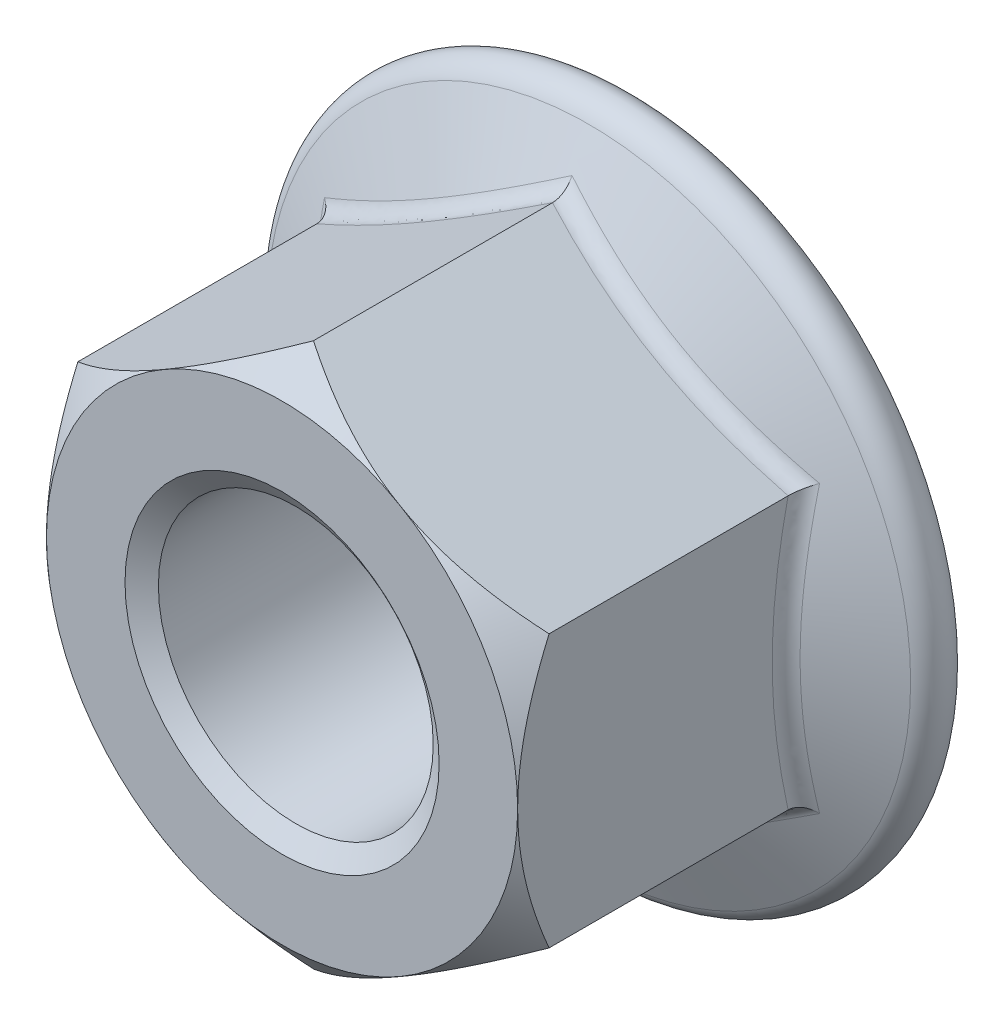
SolidWorks part; units mm, degrees
extrude "BaseNut" add sketch "BaseNutSke" against normal blind 22.5298
sketch "BaseNutSke" plane through (0, 0, 0) normal (0, 0, 1) x (1, 0, 0)
  line L6 (15, 8.6603) -> (15, -8.6603)
  line L7 (-15, 8.6603) -> (-15, -8.6603)
  line L8 (15, 8.6603) -> (0, 17.3205)
  line L9 (0, 17.3205) -> (-15, 8.6603)
  line L10 (-15, -8.6603) -> (0, -17.3205)
  line L11 (0, -17.3205) -> (15, -8.6603)
  circle A0 centre (0, 0) radius 8.75
pattern_linear "ThdSchPat" [suppressed]
revolve "ThreadSchematic" cut sketch "ThdSchSke" angle 360 about L6
sketch "ThdSchSke" plane through (0, 0, 0) normal (0, 1, 0) x (1, 0, 0)
  line L0 (-10, 0.0254) -> (-8.75, 0.9007)
  line L1 (-8.75, 0.9007) -> (-4.375, 0.9007)
  line L2 (-4.375, 0.9007) -> (-4.375, -0.8499)
  line L3 (-4.375, -0.8499) -> (-8.75, -0.8499)
  line L4 (-8.75, -0.8499) -> (-10, 0.0254)
  line L5 (-3.175, 3.175) -> (3.175, 3.175) construction
  line L6 (0, 3.175) -> (0, -2.9874) construction
  line L7 (0, 21.6291) -> (0, 0.8753) construction
ref_plane "Plane1" through (0, 0, 0) normal (0, 0, 1) x (1, 0, 0)
ref_plane "Plane2" through (0, 0, 0) normal (0, 1, 0) x (1, 0, 0)
ref_plane "Plane3" through (0, 0, 0) normal (1, 0, 0) x (0, 0, -1)
other "Configuration Table"
sketch "Sketch6" plane through (0, 0, 0) normal (1, 0, 0) x (0, 0, -1)
  line L0 (14.0547, 8.75) -> (19.5298, 20.4914)
  line L1 (22.5298, 8.75) -> (22.5298, 19.8263)
  line L2 (19.5298, 32.3999) -> (19.5298, 20.4914) construction
  line L3 (23.6804, 21.4) -> (19.4832, 21.4) construction
  line L4 (22.5298, 8.75) -> (14.0547, 8.75)
  line L5 (23.6804, -21.4) -> (19.4832, -21.4) construction
  line L6 (22.5298, 8.6603) -> (22.5298, 17.3205) construction
  line L7 (0, 0) -> (32.9582, 0) construction
  line L8 (22.5298, -8.75) -> (14.0547, -8.75) construction
  line L9 (22.5298, 0) -> (0, 0) construction
  arc A0 (22.5298, 19.8263) -> (19.5298, 20.4914) centre (20.9561, 19.8263) ccw
revolve "Flange" add sketch "Sketch6" angle 360 about L7
sketch "Sketch3" plane through (0, 0, 0) normal (1, 0, 0) x (0, 0, -1)
  line L0 (22.5298, 15) -> (20.5298, 17.3205) construction
  line L1 (20.5298, 17.3205) -> (20.5298, 30.0205) construction
  line L2 (20.5298, 30.0205) -> (35.2298, 30.0205) construction
  line L3 (35.2298, 30.0205) -> (35.2298, 15) construction
  line L4 (35.2298, 15) -> (22.5298, 15) construction
  line L5 (22.5298, 8.6603) -> (22.5298, 17.3205) construction
  line L6 (18.0512, 17.3205) -> (0, 17.3205) construction
  line L7 (0, 0) -> (38.6776, 0) construction
  line L8 (22.5298, 0) -> (0, 0) construction
  line L9 (11.2649, 17.3205) -> (11.2649, 44.222) construction
  line L10 (2, 30.0205) -> (-12.7, 30.0205)
  line L11 (-12.7, 30.0205) -> (-12.7, 15)
  line L12 (-12.7, 15) -> (0, 15)
  line L13 (0, 15) -> (2, 17.3205)
  line L14 (2, 17.3205) -> (2, 30.0205)
  line L16 (18.0512, 17.3205) -> (0, 17.3205) construction
revolve "Double-Chamfer" cut sketch "Sketch3" angle 360 about L7
fillet "FlangeFillet" radius 1.2 6 edges at (4.0104, 15.0051, -17.2171) (-10.9896, 10.9757, -17.2171) (-4.0104, -15.0051, -17.2171) (10.9896, -10.9757, -17.2171)
sketch "Sketch5" plane through (0, 0, 0) normal (1, 0, 0) x (0, 0, -1)
  line L0 (22.5044, 10) -> (21.5416, 8.625)
  line L1 (22.5552, 10) -> (22.5044, 10)
  line L2 (22.5552, 10) -> (22.5552, 8.625)
  line L3 (22.5552, 8.625) -> (21.5416, 8.625)
  line L6 (-0.0508, 10) -> (0, 10)
  line L7 (0, 10) -> (0.9628, 8.625)
  line L9 (0.9628, 8.625) -> (-0.0508, 8.625)
  line L10 (-0.0508, 8.625) -> (-0.0508, 10)
  line L11 (25.0375, 0) -> (38.388, 0) construction
  line L12 (22.5298, 0) -> (0, 0) construction
revolve "EndChamfer" cut sketch "Sketch5" angle 360 about L11
equation "\"D2@BaseNutSke\" = \"Width_flats@BaseNutSke\" / 2"
equation "\"D3@BaseNutSke\" = \"Width_flats@BaseNutSke\" / 2"
equation "\"D1@Sketch3\" = \"Width_flats@BaseNutSke\" /2"
equation "\"D2@Sketch3\" = \"Thread_major@ThreadCosmetic\" *.1"
equation "\"D4@BaseNutSke\" = \"D3@BaseNutSke\""
equation "' \"Thread_major@ThdSchSke\" = \"Thread_major@ThreadCosmetic\""
equation "\"Tap_Drill@ThdSchSke\" = \"Tap_drill@BaseNutSke\""
equation "\"OverCut@ThdSchSke\" = \"Tap_Drill@ThdSchSke\" * 0.5"
equation "\"Num_threads@ThdSchPat\" = int(  ( \"Thickness@BaseNut\" - 0.0508 ) / \"Advance@ThdSchSke\" + 0.999 )  + 1"
equation "\"Advance@ThdSchPat\" = ( \"Thickness@BaseNut\" - 0.0508 ) /  (\"Num_threads@ThdSchPat\" - 1) 'relax it"
equation "\"ThreadMajor@Sketch5\" = \"Thread_major@ThdSchSke\" * 0.5"
equation "\"ChamferDepth@Sketch5\" = (\"Thread_major@ThdSchSke\" - \"Tap_drill@BaseNutSke\") * 0.55"
equation "\"Offset1@Sketch5\" = \"Thickness@BaseNut\" + 0.0254"
equation "\"Offset2@Sketch5\" = \"Offset1@Sketch5\" + 0.0508"
equation "\"D1@Sketch6\" = \"Tap_drill@BaseNutSke\""
equation "\"D5@Sketch3\" = \"Thickness@BaseNut\" / 2"
